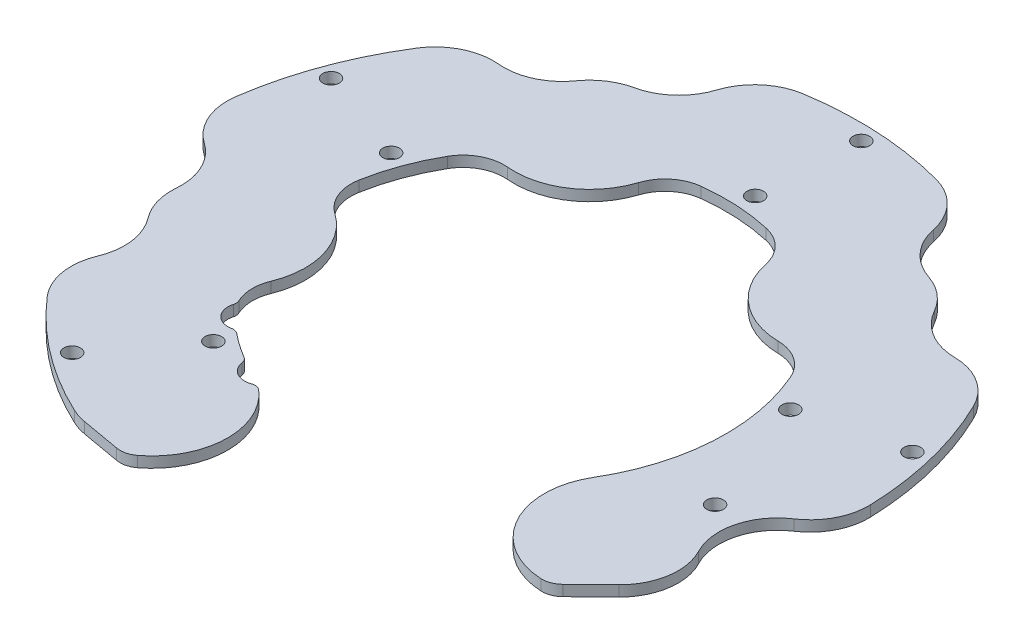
SolidWorks part; units mm, degrees
ref_plane "Front Plane" through (0, 0, 0) normal (0, 0, 1) x (1, 0, 0)
ref_plane "Top Plane" through (0, 0, 0) normal (0, 1, 0) x (1, 0, 0)
ref_plane "Right Plane" through (0, 0, 0) normal (1, 0, 0) x (0, 0, -1)
sketch "Sketch1" plane through (0, 0, 0) normal (0, 1, 0) x (1, 0, 0)
  arc A0 (56.1044, -33.3693) -> (59.7737, 26.236) centre (0, 0) ccw
  arc A1 (-51.0146, -26.2866) -> (-47.6314, -44.637) centre (-35.0286, -32.8264) ccw
  arc A2 (-68.2527, 61.1307) -> (-52.5449, 68.3132) centre (-66.619, 78.3253) ccw
  arc A3 (-42.1405, 75.1787) -> (-29.3588, 86.7955) centre (-45.81, 92.0564) ccw
  arc A4 (38.5076, 83.1418) -> (49.9682, 70.2199) centre (55.4286, 86.6061) ccw
  arc A5 (59.5755, 62.277) -> (74.4214, 53.4496) centre (74.6431, 70.7202) ccw
  arc A6 (92.029, -11.7615) -> (86.2498, -34.1853) centre (101.5504, -26.1721) ccw
  arc A7 (-57.1167, -5.5825) -> (-64.2265, 11.6695) centre (-47.2327, 8.5819) cw
  arc A8 (-56.6114, 32.5017) -> (-40.0517, 41.1016) centre (-41.6325, 23.9021) cw
  arc A9 (-22.0358, 52.9896) -> (-7.6159, 64.8322) centre (-5.6008, 47.6782) cw
  arc A10 (14.5324, 63.6398) -> (27.5975, 50.3175) centre (10.6873, 46.8013) cw
  arc A11 (44.233, 36.564) -> (59.7737, 26.236) centre (43.9581, 19.2941) cw
  arc A12 (-47.6314, -44.637) -> (-27.5877, -59.162) centre (0, 0) ccw
  circle A13 centre (-34.8871, -74.8157) radius 17.272
  arc A14 (-42.1866, -90.4695) -> (-27.5877, -59.162) centre (-34.8871, -74.8157) ccw
  arc A15 (-56.6114, 32.5017) -> (-64.2265, 11.6695) centre (0, 0) ccw
  circle A16 centre (-62.4471, -53.9894) radius 17.272
  arc A17 (-78.413, -47.4005) -> (-75.513, -65.2857) centre (-62.4471, -53.9894) ccw
  arc A18 (14.5324, 63.6398) -> (-7.6159, 64.8322) centre (0, 0) ccw
  circle A19 centre (-67.0006, -19.7468) radius 17.272
  arc A20 (-84.2138, -18.3222) -> (-80.6897, -30.2792) centre (-67.0006, -19.7468) ccw
  arc A21 (27.5975, 50.3175) -> (44.233, 36.564) centre (44.5078, 53.8338) ccw
  circle A22 centre (-81.7462, 11.4919) radius 17.272
  arc A23 (-98.85, 13.8963) -> (-91.5866, -2.7028) centre (-81.7462, 11.4919) ccw
  arc A24 (-40.0517, 41.1016) -> (-22.0358, 52.9896) centre (-38.4709, 58.3011) ccw
  circle A25 centre (-69.8864, 43.9362) radius 17.272
  arc A26 (-68.2527, 61.1307) -> (-84.5088, 53.129) centre (-69.8864, 43.9362) ccw
  arc A27 (-51.0146, -26.2866) -> (-57.1167, -5.5825) centre (-67.0006, -19.7468) ccw
  circle A28 centre (-38.4709, 58.3011) radius 17.272
  arc A29 (-42.1405, 75.1787) -> (-52.5449, 68.3132) centre (-38.4709, 58.3011) ccw
  arc A30 (-84.5088, 53.129) -> (-98.85, 13.8963) centre (0, 0) ccw
  circle A31 centre (-12.9075, 81.5347) radius 17.272
  arc A32 (-15.6081, 98.5942) -> (-29.3588, 86.7955) centre (-12.9075, 81.5347) ccw
  arc A33 (26.1032, 96.3486) -> (-15.6081, 98.5942) centre (0, 0) ccw
  circle A34 centre (21.5866, 79.6776) radius 17.272
  arc A35 (38.5076, 83.1418) -> (26.1032, 96.3486) centre (21.5866, 79.6776) ccw
  arc A36 (99.7706, 3.2032) -> (89.7244, 43.7488) centre (0, 0) ccw
  circle A37 centre (44.5078, 53.8338) radius 17.272
  arc A38 (59.5755, 62.277) -> (49.9682, 70.2199) centre (44.5078, 53.8338) ccw
  circle A40 centre (74.1996, 36.1791) radius 17.272
  arc A41 (89.7244, 43.7488) -> (74.4214, 53.4496) centre (74.1996, 36.1791) ccw
  circle A44 centre (82.5075, 2.649) radius 17.272
  arc A45 (92.029, -11.7615) -> (99.7706, 3.2032) centre (82.5075, 2.649) ccw
  arc A46 (-75.513, -65.2857) -> (-42.1866, -90.4695) centre (0, 0) ccw
  circle A47 centre (70.9492, -42.1986) radius 17.272
  arc A48 (56.1044, -33.3693) -> (86.2498, -34.1853) centre (70.9492, -42.1986) ccw
  arc A49 (-80.6897, -30.2792) -> (-78.413, -47.4005) centre (-94.3788, -40.8116) cw
  arc A50 (-91.5866, -2.7028) -> (-84.2138, -18.3222) centre (-101.4269, -16.8975) cw
  dimension "D1" = 0
  dimension "D2" = 0
  dimension "D3" = 0
  dimension "D4" = 0
  dimension "D5" = 0
  dimension "D6" = 0
  dimension "D7" = 0
  dimension "D8" = 0
  dimension "D9" = 0
  dimension "D10" = 0
  dimension "D11" = 0
  dimension "D12" = 0
extrude "Boss-Extrude1" add sketch "Sketch1" along normal blind 3.175
sketch "Sketch4" plane through (0, 3.175, 0) normal (0, 1, 0) x (1, 0, 0)
  line L0 (-37.8864, -91.8253) -> (-26.369, -93.8561)
  line L1 (83.0029, -54.5691) -> (74.6267, -62.7308)
  line L2 (0, 0) -> (-34.8871, -74.8157) construction
  line L3 (0, 0) -> (70.9492, -42.1986) construction
  line L4 (-34.8871, -74.8157) -> (-7.033, -87.8043) construction
  line L5 (70.9492, -42.1986) -> (52.2375, -73.6588) construction
  arc A0 (-45.927, -39.7811) -> (-40.0775, -46.1726) centre (-41.045, -41.1856) ccw
  arc A1 (-29.6581, -53.4668) -> (-22.8521, -57.4267) centre (-24.6407, -52.672) ccw
  circle A2 centre (-41.045, -41.1856) radius 4.658 construction
  circle A3 centre (-24.6407, -52.672) radius 4.658 construction
  arc A4 (-22.8521, -57.4267) -> (-20.3002, -57.8795) centre (-21.9578, -59.8041) cw
  arc A5 (-29.6581, -53.4668) -> (-30.8645, -51.6835) centre (-32.1668, -53.8642) ccw
  arc A6 (-40.0775, -46.1726) -> (-37.9908, -46.6958) centre (-39.5938, -48.6661) cw
  arc A7 (-45.927, -39.7811) -> (-46.0681, -38.0008) centre (-48.368, -39.0788) ccw
  arc A8 (-42.1866, -90.4695) -> (-27.5877, -59.162) centre (-34.8871, -74.8157) ccw construction
  arc A9 (-42.1866, -90.4695) -> (-27.5877, -59.162) centre (-34.8871, -74.8157) ccw construction
  arc A10 (-26.369, -93.8561) -> (-21.4486, -92.6768) centre (-25.2664, -87.6026) ccw
  arc A12 (69.896, -64.5258) -> (74.6267, -62.7308) centre (70.1952, -58.1828) ccw
  arc A36 (56.1044, -33.3693) -> (86.2498, -34.1853) centre (70.9492, -42.1986) ccw construction
  arc A37 (51.7383, -30.7725) -> (55.122, 24.1942) centre (0, 0) ccw
  arc A38 (51.7383, -30.7725) -> (55.122, 24.1942) centre (0, 0) ccw
  arc A39 (-43.9247, -41.1633) -> (-25.4408, -54.5579) centre (0, 0) ccw
  arc A40 (-37.9908, -46.6958) -> (-30.8645, -51.6835) centre (0, 0) ccw
  arc A41 (-52.2059, 29.9724) -> (-59.2283, 10.7614) centre (0, 0) ccw
  arc A42 (-52.2059, 29.9724) -> (-59.2283, 10.7614) centre (0, 0) ccw
  arc A43 (13.4015, 58.6873) -> (-7.0232, 59.7869) centre (0, 0) ccw
  arc A44 (13.4015, 58.6873) -> (-7.0232, 59.7869) centre (0, 0) ccw
  arc A72 (55.122, 24.1942) -> (44.1521, 31.4846) centre (43.9581, 19.2941) ccw
  arc A74 (51.7383, -30.7725) -> (90.75, -31.8285) centre (70.9492, -42.1986) ccw
  arc A75 (94.8294, -15.9999) -> (90.75, -31.8285) centre (101.5504, -26.1721) ccw
  arc A76 (94.8294, -15.9999) -> (104.848, 3.3662) centre (82.5075, 2.649) ccw
  arc A77 (104.848, 3.3662) -> (94.2905, 45.9752) centre (0, 0) ccw
  arc A78 (94.2905, 45.9752) -> (74.4866, 58.5292) centre (74.1996, 36.1791) ccw
  arc A79 (64.0071, 64.7603) -> (74.4866, 58.5292) centre (74.6431, 70.7202) ccw
  arc A80 (64.0071, 64.7603) -> (51.5742, 75.0394) centre (44.5078, 53.8338) ccw
  arc A81 (43.4844, 84.1607) -> (51.5742, 75.0394) centre (55.4286, 86.6061) ccw
  arc A82 (43.4844, 84.1607) -> (27.4316, 101.2519) centre (21.5866, 79.6776) ccw
  arc A83 (27.4316, 101.2519) -> (-16.4024, 103.6117) centre (0, 0) ccw
  arc A84 (-16.4024, 103.6117) -> (-34.1974, 88.3429) centre (-12.9075, 81.5347) ccw
  arc A85 (-43.2197, 80.1428) -> (-34.1974, 88.3429) centre (-45.81, 92.0564) ccw
  arc A86 (-43.2197, 80.1428) -> (-56.6844, 71.2579) centre (-38.4709, 58.3011) ccw
  arc A87 (-67.7722, 66.188) -> (-56.6844, 71.2579) centre (-66.619, 78.3253) ccw
  arc A88 (-67.7722, 66.188) -> (-88.8095, 55.8327) centre (-69.8864, 43.9362) ccw
  arc A89 (-88.8095, 55.8327) -> (-103.8805, 14.6035) centre (0, 0) ccw
  arc A90 (-103.8805, 14.6035) -> (-94.4808, -6.8777) centre (-81.7462, 11.4919) ccw
  arc A91 (-89.2765, -17.9032) -> (-94.4808, -6.8777) centre (-101.4269, -16.8975) ccw
  arc A92 (-89.2765, -17.9032) -> (-84.7159, -33.377) centre (-67.0006, -19.7468) ccw
  arc A93 (-83.1088, -45.4626) -> (-84.7159, -33.377) centre (-94.3788, -40.8116) ccw
  arc A94 (-83.1088, -45.4626) -> (-79.3559, -68.6081) centre (-62.4471, -53.9894) ccw
  arc A95 (-79.3559, -68.6081) -> (-44.3335, -95.0735) centre (0, 0) ccw
  arc A96 (-44.3335, -95.0735) -> (-25.4408, -54.5579) centre (-34.8871, -74.8157) ccw
  arc A98 (-46.3128, -28.2101) -> (-43.9247, -41.1633) centre (-35.0286, -32.8264) ccw
  arc A99 (-46.3128, -28.2101) -> (-54.2096, -1.4165) centre (-67.0006, -19.7468) ccw
  arc A100 (-59.2283, 10.7614) -> (-54.2096, -1.4165) centre (-47.2327, 8.5819) ccw
  arc A102 (-40.5167, 36.0429) -> (-52.2059, 29.9724) centre (-41.6325, 23.9021) ccw
  arc A103 (-40.5167, 36.0429) -> (-17.202, 51.4274) centre (-38.4709, 58.3011) ccw
  arc A104 (-7.0232, 59.7869) -> (-17.202, 51.4274) centre (-5.6008, 47.6782) ccw
  arc A106 (22.6239, 49.2833) -> (13.4015, 58.6873) centre (10.6873, 46.8013) ccw
  arc A107 (22.6239, 49.2833) -> (44.1521, 31.4846) centre (44.5078, 53.8338) ccw
  arc A108 (55.122, 24.1942) -> (44.1521, 31.4846) centre (43.9581, 19.2941) ccw
  arc A110 (51.7383, -30.7725) -> (69.896, -64.5258) centre (70.9492, -42.1986) ccw
  arc A132 (-21.4486, -92.6768) -> (-20.3002, -57.8795) centre (-34.8871, -74.8157) ccw
  arc A134 (-46.3128, -28.2101) -> (-46.0681, -38.0008) centre (-35.0286, -32.8264) ccw
  arc A135 (-46.3128, -28.2101) -> (-54.2096, -1.4165) centre (-67.0006, -19.7468) ccw
  arc A136 (-59.2283, 10.7614) -> (-54.2096, -1.4165) centre (-47.2327, 8.5819) ccw
  arc A138 (-40.5167, 36.0429) -> (-52.2059, 29.9724) centre (-41.6325, 23.9021) ccw
  arc A139 (-40.5167, 36.0429) -> (-17.202, 51.4274) centre (-38.4709, 58.3011) ccw
  arc A140 (-7.0232, 59.7869) -> (-17.202, 51.4274) centre (-5.6008, 47.6782) ccw
  arc A142 (22.6239, 49.2833) -> (13.4015, 58.6873) centre (10.6873, 46.8013) ccw
  arc A143 (22.6239, 49.2833) -> (44.1521, 31.4846) centre (44.5078, 53.8338) ccw
  arc A181 (59.7737, 26.236) -> (44.233, 36.564) centre (43.9581, 19.2941) ccw
  arc A182 (56.1044, -33.3693) -> (59.7737, 26.236) centre (0, 0) ccw
  arc A183 (56.1044, -33.3693) -> (86.2498, -34.1853) centre (70.9492, -42.1986) ccw
  arc A184 (92.029, -11.7615) -> (86.2498, -34.1853) centre (101.5504, -26.1721) ccw
  arc A185 (92.029, -11.7615) -> (99.7706, 3.2032) centre (82.5075, 2.649) ccw
  arc A186 (99.7706, 3.2032) -> (89.7244, 43.7488) centre (0, 0) ccw
  arc A187 (89.7244, 43.7488) -> (74.4214, 53.4496) centre (74.1996, 36.1791) ccw
  arc A188 (59.5755, 62.277) -> (74.4214, 53.4496) centre (74.6431, 70.7202) ccw
  arc A189 (59.5755, 62.277) -> (49.9682, 70.2199) centre (44.5078, 53.8338) ccw
  arc A190 (38.5076, 83.1418) -> (49.9682, 70.2199) centre (55.4286, 86.6061) ccw
  arc A191 (38.5076, 83.1418) -> (26.1032, 96.3486) centre (21.5866, 79.6776) ccw
  arc A192 (26.1032, 96.3486) -> (-15.6081, 98.5942) centre (0, 0) ccw
  arc A193 (-15.6081, 98.5942) -> (-29.3588, 86.7955) centre (-12.9075, 81.5347) ccw
  arc A194 (-42.1405, 75.1787) -> (-29.3588, 86.7955) centre (-45.81, 92.0564) ccw
  arc A195 (-42.1405, 75.1787) -> (-52.5449, 68.3132) centre (-38.4709, 58.3011) ccw
  arc A196 (-68.2527, 61.1307) -> (-52.5449, 68.3132) centre (-66.619, 78.3253) ccw
  arc A197 (-68.2527, 61.1307) -> (-84.5088, 53.129) centre (-69.8864, 43.9362) ccw
  arc A198 (-84.5088, 53.129) -> (-98.85, 13.8963) centre (0, 0) ccw
  arc A199 (-98.85, 13.8963) -> (-91.5866, -2.7028) centre (-81.7462, 11.4919) ccw
  arc A200 (-84.2138, -18.3222) -> (-91.5866, -2.7028) centre (-101.4269, -16.8975) ccw
  arc A201 (-84.2138, -18.3222) -> (-80.6897, -30.2792) centre (-67.0006, -19.7468) ccw
  arc A202 (-78.413, -47.4005) -> (-80.6897, -30.2792) centre (-94.3788, -40.8116) ccw
  arc A203 (-78.413, -47.4005) -> (-75.513, -65.2857) centre (-62.4471, -53.9894) ccw
  arc A204 (-75.513, -65.2857) -> (-42.1866, -90.4695) centre (0, 0) ccw
  arc A205 (-42.1866, -90.4695) -> (-27.5877, -59.162) centre (-34.8871, -74.8157) ccw
  arc A206 (-47.6314, -44.637) -> (-27.5877, -59.162) centre (0, 0) ccw
  arc A207 (-51.0146, -26.2866) -> (-47.6314, -44.637) centre (-35.0286, -32.8264) ccw
  arc A208 (-51.0146, -26.2866) -> (-57.1167, -5.5825) centre (-67.0006, -19.7468) ccw
  arc A209 (-64.2265, 11.6695) -> (-57.1167, -5.5825) centre (-47.2327, 8.5819) ccw
  arc A210 (-56.6114, 32.5017) -> (-64.2265, 11.6695) centre (0, 0) ccw
  arc A211 (-40.0517, 41.1016) -> (-56.6114, 32.5017) centre (-41.6325, 23.9021) ccw
  arc A212 (-40.0517, 41.1016) -> (-22.0358, 52.9896) centre (-38.4709, 58.3011) ccw
  arc A213 (-7.6159, 64.8322) -> (-22.0358, 52.9896) centre (-5.6008, 47.6782) ccw
  arc A214 (14.5324, 63.6398) -> (-7.6159, 64.8322) centre (0, 0) ccw
  arc A215 (27.5975, 50.3175) -> (14.5324, 63.6398) centre (10.6873, 46.8013) ccw
  arc A216 (27.5975, 50.3175) -> (44.233, 36.564) centre (44.5078, 53.8338) ccw
  arc A217 (59.7737, 26.236) -> (44.233, 36.564) centre (43.9581, 19.2941) ccw
  arc A218 (56.1044, -33.3693) -> (59.7737, 26.236) centre (0, 0) ccw
  arc A219 (56.1044, -33.3693) -> (83.0029, -54.5691) centre (70.9492, -42.1986) ccw
  arc A241 (-37.8864, -91.8253) -> (-27.5877, -59.162) centre (-34.8871, -74.8157) ccw
  arc A242 (-47.6314, -44.637) -> (-27.5877, -59.162) centre (0, 0) ccw
  arc A243 (-51.0146, -26.2866) -> (-47.6314, -44.637) centre (-35.0286, -32.8264) ccw
  arc A244 (-51.0146, -26.2866) -> (-57.1167, -5.5825) centre (-67.0006, -19.7468) ccw
  arc A245 (-64.2265, 11.6695) -> (-57.1167, -5.5825) centre (-47.2327, 8.5819) ccw
  arc A246 (-56.6114, 32.5017) -> (-64.2265, 11.6695) centre (0, 0) ccw
  arc A247 (-40.0517, 41.1016) -> (-56.6114, 32.5017) centre (-41.6325, 23.9021) ccw
  arc A248 (-40.0517, 41.1016) -> (-22.0358, 52.9896) centre (-38.4709, 58.3011) ccw
  arc A249 (-7.6159, 64.8322) -> (-22.0358, 52.9896) centre (-5.6008, 47.6782) ccw
  arc A250 (14.5324, 63.6398) -> (-7.6159, 64.8322) centre (0, 0) ccw
  arc A251 (27.5975, 50.3175) -> (14.5324, 63.6398) centre (10.6873, 46.8013) ccw
  arc A252 (27.5975, 50.3175) -> (44.233, 36.564) centre (44.5078, 53.8338) ccw
  dimension "D3" = 5.08
  dimension "D4" = 2.54
  dimension "D5" = 6.35
  dimension "D7" = 6.35
  dimension "D6" = 15
  dimension "D8" = 15
  dimension "D1" = 5.08
  dimension "D2" = 0
extrude "Boss-Extrude2" add sketch "Sketch4" against normal up to surface (3.175 mm away)
hole_wizard "#10 (0.1935) Diameter Hole1" positions "Sketch3" profile "Sketch2" hole size "#10" standard "ANSI Inch"
sketch "Sketch3" plane through (0, 3.175, 0) normal (0, 1, 0) x (1, 0, 0)
  line L0 (0, 0) -> (-57.4254, -75.9926) construction
  line L2 (0, 0) -> (-89.4605, 32.7015) construction
  line L3 (0, 0) -> (5.1205, 95.1123) construction
  line L4 (0, 0) -> (92.4543, 22.9078) construction
  line L5 (82.5075, 2.649) -> (70.9492, -42.1986) construction
  circle A0 centre (0, 0) radius 95.25 construction
  circle A1 centre (0, 0) radius 65.405 construction
  point P0 (-57.4254, -75.9926)
  point P2 (-89.4605, 32.7015)
  point P4 (5.1205, 95.1123)
  point P6 (92.4543, 22.9078)
  point P8 (76.7283, -19.7748)
  point P50 (-39.4321, -52.1816)
  point P52 (-61.4295, 22.455)
  point P54 (3.5161, 65.3104)
  point P56 (63.4853, 15.73)
  dimension "D1" = 190.5
  dimension "D2" = 130.81
sketch "Sketch2" plane through (-57.4254, 3.175, 75.9926) normal (1, 0, 0) x (0, 0, 1)
  line L0 (0, 0) -> (0, 3.175)
  line L1 (0, 3.175) -> (2.4574, 3.175)
  line L2 (2.4574, 3.175) -> (2.4574, 0)
  line L5 (2.4574, 0) -> (0, 0)
  line L11 (0, -6.35) -> (0, 107.95) construction
  dimension "Thru Hole Dia." = 4.9149
  dimension "Thru Hole Depth" = 3.175
